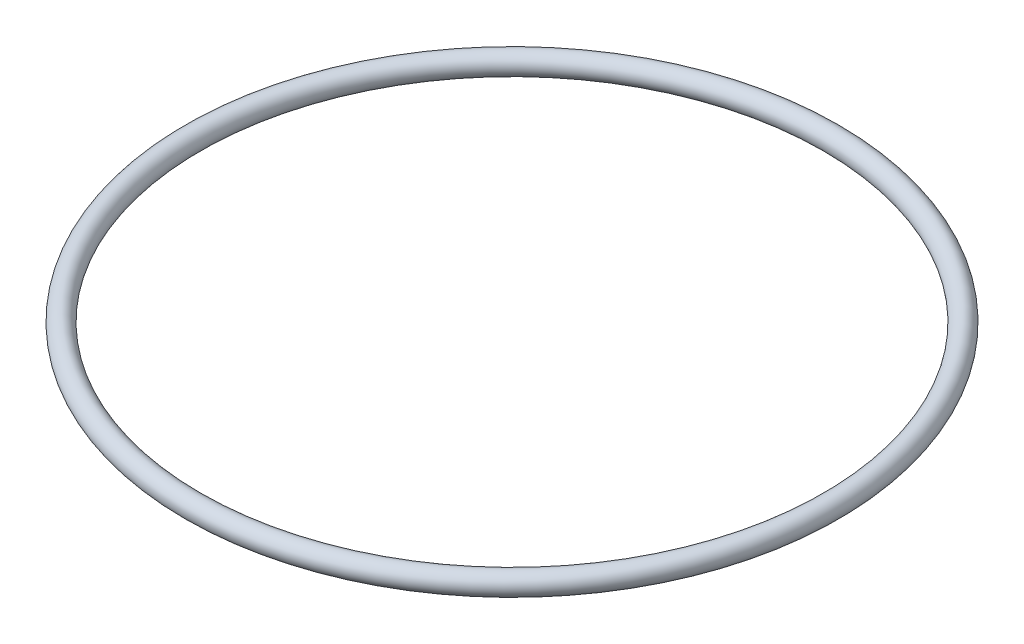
SolidWorks part; units mm, degrees
ref_plane "Front Plane" through (0, 0, 0) normal (0, 0, 1) x (1, 0, 0)
ref_plane "Top Plane" through (0, 0, 0) normal (0, 1, 0) x (1, 0, 0)
ref_plane "Right Plane" through (0, 0, 0) normal (1, 0, 0) x (0, 0, -1)
sketch "Sketch1" plane through (0, 0, 0) normal (0, 0, 1) x (1, 0, 0)
  line L0 (0, 3.7249) -> (0, 0) construction
  line L1 (0, 0) -> (37.9349, 0) construction
  circle A0 centre (39.243, 0) radius 1.3081
  dimension "D1" = 2.6162
  dimension "D2" = 75.8698
revolve "Revolve1" add sketch "Sketch1" angle 360 about L0
